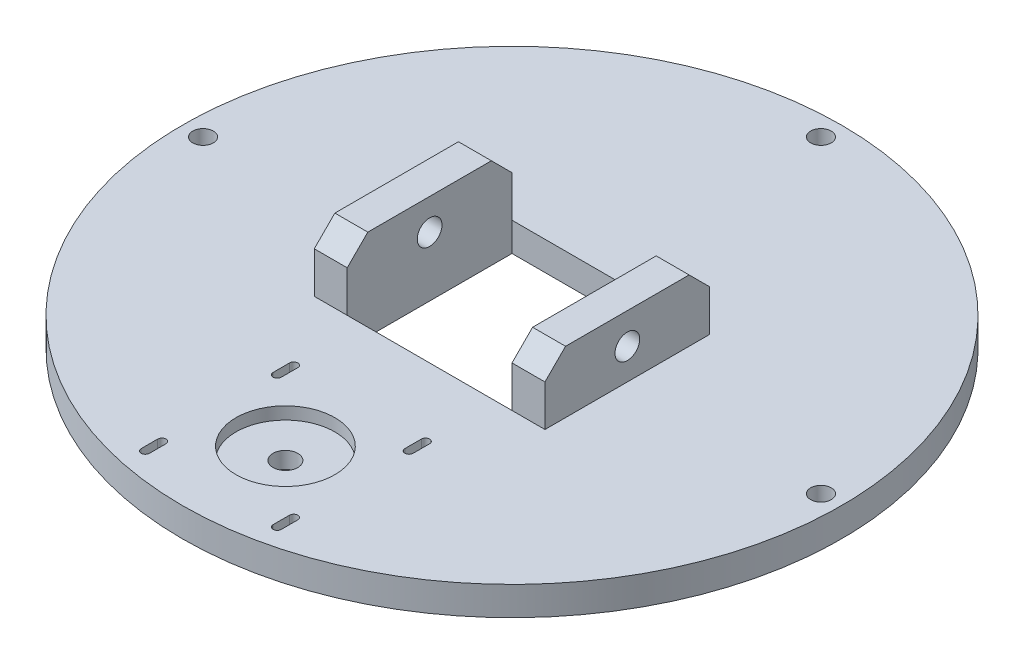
SolidWorks part; units mm, degrees
ref_plane "Front Plane" through (0, 0, 0) normal (0, 0, 1) x (1, 0, 0)
ref_plane "Top Plane" through (0, 0, 0) normal (0, 1, 0) x (1, 0, 0)
ref_plane "Right Plane" through (0, 0, 0) normal (1, 0, 0) x (0, 0, -1)
sketch "Sketch1" plane through (0, 0, 0) normal (0, 1, 0) x (1, 0, 0)
  circle A0 centre (0, 0) radius 80
  dimension "D1" = 160
extrude "Boss-Extrude1" add sketch "Sketch1" along normal blind 7 contours A0
sketch "Sketch2" plane through (0, 7, 0) normal (0, 1, 0) x (1, 0, 0)
  circle A0 centre (0, 0) radius 75 construction
  circle A1 centre (-75, 0) radius 2.5
  circle A2 centre (0, 75) radius 2.5
  circle A3 centre (75, 0) radius 2.5
  point P3 (0, 75)
  point P4 (75, 0)
  point P5 (0, -75)
  point P6 (-75, 0)
  point P7 (-75, 0)
  dimension "D1" = 150
extrude "Cut-Extrude1" cut sketch "Sketch2" against normal up to next
sketch "Sketch3" plane through (0, 7, 0) normal (0, 1, 0) x (1, 0, 0)
  line L1 (-20, 20) -> (20, 20)
  line L2 (-20, 20) -> (-20, -20)
  line L3 (-20, -20) -> (20, -20)
  line L4 (20, 20) -> (20, -20)
  dimension "D1" = 40
  dimension "D2" = 20
  dimension "D3" = 20
extrude "Cut-Extrude2" cut sketch "Sketch3" against normal up to next
sketch "Sketch5" plane through (0, 7, 0) normal (0, 1, 0) x (1, 0, 0)
  line L0 (-20, -20) -> (20, -20) construction
  line L1 (-20, 20) -> (-28, 20)
  line L2 (-20, 20) -> (-20, -20)
  line L3 (-20, -20) -> (-28, -20)
  line L4 (-28, 20) -> (-28, -20)
  dimension "D1" = 8
extrude "Boss-Extrude2" add sketch "Sketch5" along normal blind 15
fillet "Fillet1" radius 5 2 edges at (-24, 22, -20) (-24, 22, 20)
sketch "Sketch6" plane through (-28, 0, 0) normal (-1, 0, 0) x (0, 0, 1)
  line L0 (-15, 22) -> (15, 22) construction
  line L2 (20, 17) -> (20, 7) construction
  circle A0 centre (0, 14.5) radius 3
  dimension "D1" = 6
  dimension "D2" = 7.5
  dimension "D3" = 20
extrude "Cut-Extrude4" cut sketch "Sketch6" against normal up to next
ref_plane "Plane1" [suppressed] through (0, 0, 0) normal (-1, 0, 0) x (0, 0, 1)
mirror "Mirror1" about plane through (0, 0, 0) normal (-1, 0, 0) of "Cut-Extrude4", "Fillet1", "Boss-Extrude2"
sketch "Sketch4" plane through (0, 7, 0) normal (0, 1, 0) x (1, 0, 0)
  line L0 (-16, -41) -> (-16, -37) construction
  line L5 (-21, -34) -> (21, -34) construction
  line L6 (0, 0) -> (0, -80) construction
  line L7 (0, 0) -> (-72.5, 0) construction
  line L8 (-21, -34) -> (-21, -76) construction
  line L23 (-21, -76) -> (21, -76) construction
  line L24 (21, -34) -> (21, -76) construction
  line L27 (-16, -39) -> (16, -39) construction
  line L28 (-16, -39) -> (-16, -71) construction
  line L31 (-16, -71) -> (16, -71) construction
  line L32 (16, -39) -> (16, -71) construction
  line L33 (-17, -41) -> (-17, -37)
  line L34 (-15, -41) -> (-15, -37)
  line L35 (16, -41) -> (16, -37) construction
  line L36 (15, -41) -> (15, -37)
  line L37 (17, -41) -> (17, -37)
  line L38 (16, -73) -> (16, -69) construction
  line L39 (15, -73) -> (15, -69)
  line L40 (17, -73) -> (17, -69)
  line L41 (-16, -73) -> (-16, -69) construction
  line L42 (-17, -73) -> (-17, -69)
  line L43 (-15, -73) -> (-15, -69)
  circle A11 centre (-75, 0) radius 2.5 construction
  arc A22 (-17, -41) -> (-15, -41) centre (-16, -41) ccw
  arc A23 (-15, -37) -> (-17, -37) centre (-16, -37) ccw
  arc A24 (15, -41) -> (17, -41) centre (16, -41) ccw
  arc A25 (17, -37) -> (15, -37) centre (16, -37) ccw
  arc A26 (15, -73) -> (17, -73) centre (16, -73) ccw
  arc A27 (17, -69) -> (15, -69) centre (16, -69) ccw
  arc A28 (-17, -73) -> (-15, -73) centre (-16, -73) ccw
  arc A29 (-15, -69) -> (-17, -69) centre (-16, -69) ccw
  circle A30 centre (0, -55) radius 3
  circle A31 centre (0, 0) radius 80 construction
  point P2 (0, 0)
  point P17 (-16, -39)
  point P26 (16, -39)
  point P33 (16, -71)
  point P42 (-16, -71)
  point P47 (0, -73)
  dimension "D5" = 5
  dimension "D8" = 5
  dimension "D10" = 2
  dimension "D9" = 2
  dimension "D11" = 2
  dimension "D12" = 2
  dimension "D1" = 21
  dimension "D7" = 5
  dimension "D13" = 6
  dimension "D2" = 21
  dimension "D3" = 34
  dimension "D4" = 42
  dimension "D6" = 5
  dimension "D14" = 55
extrude "Cut-Extrude3" cut sketch "Sketch4" against normal up to next
sketch "Sketch7" plane through (0, 0, 0) normal (0, -1, 0) x (1, 0, 0)
  line L0 (-15, 69) -> (-15, 73) construction
  line L1 (-15, 69) -> (-15, 73)
  line L2 (-16, 69) -> (-16, 73) construction
  line L3 (-18.5, 69) -> (-18.5, 73)
  line L4 (-13.5, 69) -> (-13.5, 73)
  line L5 (17, 69) -> (17, 73)
  line L6 (16, 69) -> (16, 73) construction
  line L7 (13.5, 69) -> (13.5, 73)
  line L8 (18.5, 69) -> (18.5, 73)
  line L9 (17, 37) -> (17, 41)
  line L10 (16, 37) -> (16, 41) construction
  line L11 (13.5, 37) -> (13.5, 41)
  line L12 (18.5, 37) -> (18.5, 41)
  line L13 (-15, 37) -> (-15, 41)
  line L14 (-16, 37) -> (-16, 41) construction
  line L15 (-18.5, 37) -> (-18.5, 41)
  line L16 (-13.5, 37) -> (-13.5, 41)
  arc A0 (-15, 73) -> (-17, 73) centre (-16, 73) ccw construction
  arc A1 (-15, 73) -> (-17, 73) centre (-16, 73) ccw
  arc A2 (-18.5, 69) -> (-13.5, 69) centre (-16, 69) ccw
  arc A3 (-13.5, 73) -> (-18.5, 73) centre (-16, 73) ccw
  arc A4 (17, 73) -> (15, 73) centre (16, 73) ccw
  arc A5 (13.5, 69) -> (18.5, 69) centre (16, 69) ccw
  arc A6 (18.5, 73) -> (13.5, 73) centre (16, 73) ccw
  arc A7 (17, 41) -> (15, 41) centre (16, 41) ccw
  arc A8 (13.5, 37) -> (18.5, 37) centre (16, 37) ccw
  arc A9 (18.5, 41) -> (13.5, 41) centre (16, 41) ccw
  arc A10 (-15, 41) -> (-17, 41) centre (-16, 41) ccw
  arc A11 (-18.5, 37) -> (-13.5, 37) centre (-16, 37) ccw
  arc A12 (-13.5, 41) -> (-18.5, 41) centre (-16, 41) ccw
  point P5 (-16, 71)
  point P17 (16, 71)
  point P27 (16, 39)
  point P37 (-16, 39)
  dimension "D1" = 2.5
  dimension "D2" = 2
  dimension "D3" = 2
  dimension "D4" = 2
extrude "Cut-Extrude5" cut sketch "Sketch7" against normal blind 2 contours L4 A3 L3 A2 M16 M13 M14 M15 | L8 A6 L7 A5 M20 M17 M18 M19 | L16 A12 L15 A11 M12 M9 M10 M11 | L12 A9 L11 A8 M8 M5 M6 M7
sketch "Sketch8" plane through (0, 7, 0) normal (0, 1, 0) x (1, 0, 0)
  line L0 (0, 0) -> (0, -55) construction
  line L1 (0, 0) -> (75, 0) construction
  circle A0 centre (0, -55) radius 12
  dimension "D1" = 55
  dimension "D2" = 24
extrude "Cut-Extrude6" cut sketch "Sketch8" against normal blind 3
